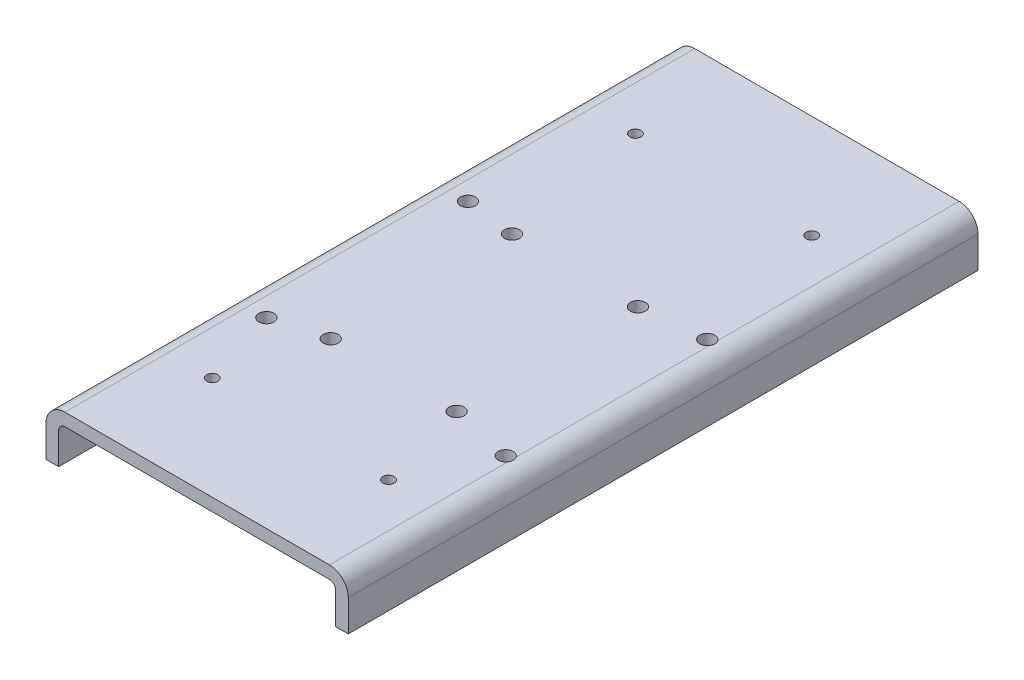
SolidWorks part; units mm, degrees
ref_plane "Plan1" through (0, 0, 0) normal (0, 0, 1) x (1, 0, 0)
ref_plane "Plan2" through (0, 0, 0) normal (0, 1, 0) x (1, 0, 0)
ref_plane "Plan3" through (0, 0, 0) normal (1, 0, 0) x (0, 0, -1)
sketch "Esquisse1" plane through (0, 0, 0) normal (0, 0, 1) x (1, 0, 0)
  line L0 (0, 0) -> (10, 0)
  line L1 (10, 0) -> (10, 25)
  line L2 (15, 30) -> (225, 30)
  line L3 (230, 25) -> (230, 0)
  line L4 (230, 0) -> (240, 0)
  line L5 (240, 0) -> (240, 25)
  line L6 (225, 40) -> (15, 40)
  line L7 (0, 25) -> (0, 0)
  arc A0 (15, 30) -> (10, 25) centre (15, 25) ccw
  arc A1 (225, 30) -> (230, 25) centre (225, 25) cw
  arc A2 (0, 25) -> (15, 40) centre (15, 25) cw
  arc A3 (240, 25) -> (225, 40) centre (225, 25) ccw
  point P15 (0, 40)
  point P18 (240, 40)
  dimension "D6" = 5
  dimension "D7" = 15
  dimension "D1" = 10
  dimension "D2" = 10
  dimension "D3" = 10
  dimension "D4" = 40
  dimension "D5" = 240
extrude "Extrusion1" add sketch "Esquisse1" along normal blind 500
hole_wizard "Trou taraudé M12x1.751" positions "Esquisse3" profile "Esquisse2" tap size "M12x1.75" standard "ISO"
sketch "Esquisse3" plane through (0, 40, 0) normal (0, 1, 0) x (-1, 0, 0)
  line L1 (-225, 0) -> (-15, 0) construction
  line L2 (-240, 500) -> (-240, 0) construction
  point P1 (-170, 200)
  dimension "D1" = 70
  dimension "D5" = 200
sketch "Esquisse2" plane through (170, 40, 200) normal (1, 0, 0) x (0, 0, 1)
  line L0 (0, 0) -> (0, 40)
  line L1 (0, 40) -> (5.1, 40)
  line L3 (5.1, 40) -> (5.1, 24)
  line L4 (5.1, 24) -> (6, 24)
  line L5 (6, 24) -> (6, 0)
  line L7 (6, 0) -> (0, 0)
  line L11 (0, -6.35) -> (0, 107.95) construction
  dimension "Diamètre du trou pour taraudage jusqu'au prochain" = 10.2
  dimension "Profondeur du trou pour taraudage jusqu'au prochain" = 40
  dimension "Diamètre principal du filetage" = 12
  dimension "Profondeur du filetage" = 24
pattern_linear "Répétition linéaire1" count 2 spacing 100 count 2 spacing 144
hole_wizard "Trou taraudé M12x1.752" positions "Esquisse5" profile "Esquisse4" tap size "M12x1.75" standard "ISO"
sketch "Esquisse5" plane through (0, 40, 0) normal (0, 1, 0) x (-1, 0, 0)
  circle A0 centre (-70, 200) radius 6 construction
  point P0 (-30, 195)
  dimension "D2" = 5
  dimension "D1" = 40
sketch "Esquisse4" plane through (30, 40, 195) normal (1, 0, 0) x (0, 0, 1)
  line L0 (0, 0) -> (0, 40)
  line L1 (0, 40) -> (5.1, 40)
  line L3 (5.1, 40) -> (5.1, 24)
  line L4 (5.1, 24) -> (6, 24)
  line L5 (6, 24) -> (6, 0)
  line L7 (6, 0) -> (0, 0)
  line L11 (0, -6.35) -> (0, 107.95) construction
  dimension "Diamètre du trou pour taraudage jusqu'au prochain" = 10.2
  dimension "Profondeur du trou pour taraudage jusqu'au prochain" = 40
  dimension "Diamètre principal du filetage" = 12
  dimension "Profondeur du filetage" = 24
pattern_linear "Répétition linéaire2" count 2 spacing 160 count 2 spacing 190
sketch "Esquisse6" plane through (0, 40, 0) normal (0, 1, 0) x (-1, 0, 0)
  line L0 (-225, 0) -> (-15, 0) construction
  line L1 (-15, 500) -> (-15, 0) construction
  line L2 (-50, 82) -> (-190, 82) construction
  line L3 (-50, 82) -> (-50, 418) construction
  circle A0 centre (-50, 82) radius 4.5
  circle A1 centre (-190, 82) radius 4.5
  circle A2 centre (-50, 418) radius 4.5
  circle A3 centre (-190, 418) radius 4.5
  dimension "D1" = 9
  dimension "D2" = 82
  dimension "D3" = 35
  dimension "D4" = 90
extrude "Enlèv. mat.-Extru.1" cut sketch "Esquisse6" against normal through all
